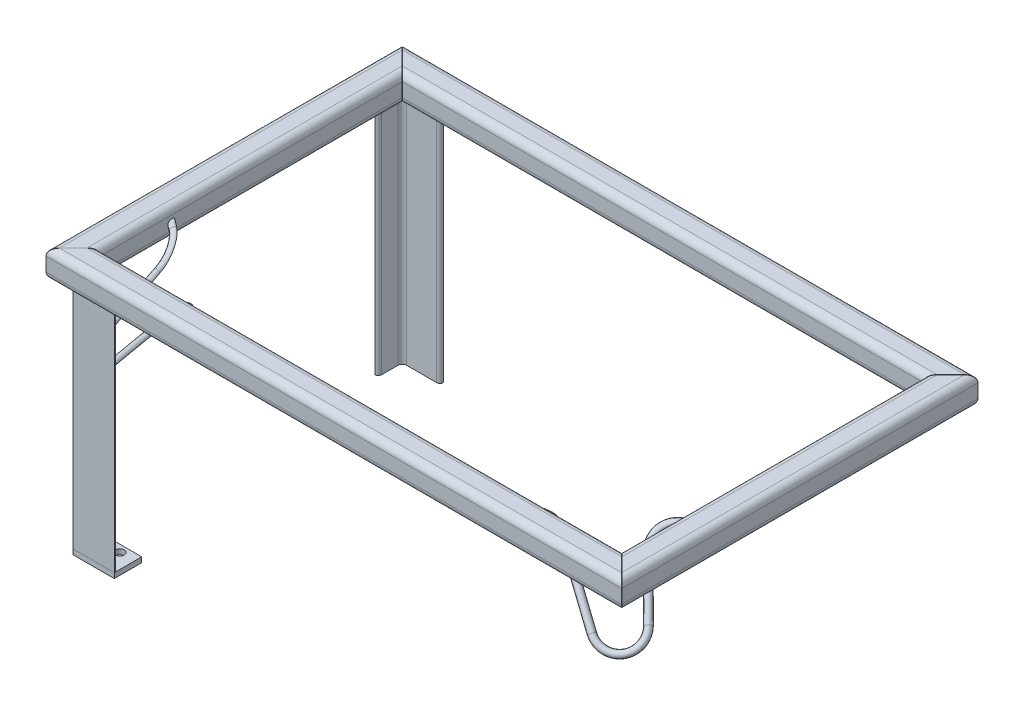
SolidWorks part; units mm, degrees
ref_plane "Front Plane" through (0, 0, 0) normal (0, 0, 1) x (1, 0, 0)
ref_plane "Top Plane" through (0, 0, 0) normal (0, 1, 0) x (1, 0, 0)
ref_plane "Right Plane" through (0, 0, 0) normal (1, 0, 0) x (0, 0, -1)
ref_plane "Plane5" through (0, 0, -12.7) normal (0, 0, 1) x (1, 0, 0)
ref_plane "Plane6" through (12.7, 0, 0) normal (1, 0, 0) x (0, 0, -1)
sketch3d "3DSketch1"
  line L0 (0, 0, 0) -> (0, 457.2, 0)
  line L1 (0, 457.2, 0) -> (1016, 457.2, 0)
  line L2 (1016, 457.2, 0) -> (1016, 0, 0)
  line L3 (1016, 457.2, 0) -> (1016, 457.2, -609.6)
  line L4 (1016, 457.2, -609.6) -> (1016, 0, -609.6)
  line L5 (1016, 457.2, -609.6) -> (0, 457.2, -609.6)
  line L6 (0, 457.2, -609.6) -> (0, 457.2, 0)
  line L7 (0, 457.2, -609.6) -> (0, 0, -609.6)
  line L8 (1016, 457.2, -177.8) -> (975.9009, 457.2, -146.6118)
  line L9 (960.2029, 423.4969, -104.912) -> (999.4101, 344.4933, -66.2784)
  line L10 (946.8823, 331.189, -13.7822) -> (864.3289, 436.8012, -41.9846)
  line L11 (827.4991, 457.2, -31.1882) -> (787.4, 457.2, 0)
  line L13 (0, 457.2, -177.8) -> (40.0991, 457.2, -146.6118)
  line L14 (55.7971, 423.4969, -104.912) -> (16.5899, 344.4933, -66.2784)
  line L15 (69.1177, 331.189, -13.7822) -> (151.6711, 436.8012, -41.9846)
  line L16 (188.5009, 457.2, -31.1882) -> (228.6, 457.2, 0)
  arc A0 (40.0991, 457.2, -146.6118) -> (55.7971, 423.4969, -104.912) centre (26.8058, 425.8507, -129.5204) ccw
  arc A1 (16.5899, 344.4933, -66.2784) -> (69.1177, 331.189, -13.7822) centre (45.5813, 342.1396, -41.67) ccw
  arc A2 (151.6711, 436.8012, -41.9846) -> (188.5009, 457.2, -31.1882) centre (175.2076, 425.8507, -14.0968) ccw
  arc A3 (975.9009, 457.2, -146.6118) -> (960.2029, 423.4969, -104.912) centre (989.1942, 425.8507, -129.5204) ccw
  arc A4 (999.4101, 344.4933, -66.2784) -> (946.8823, 331.189, -13.7822) centre (970.4187, 342.1396, -41.67) ccw
  arc A5 (864.3289, 436.8012, -41.9846) -> (827.4991, 457.2, -31.1882) centre (840.7924, 425.8507, -14.0968) ccw
  point P2 (1016, 457.2, -177.8)
  point P10 (0, 254, 0)
  point P11 (228.6, 457.2, 0)
  point P12 (0, 457.2, -177.8)
  point P13 (787.4, 457.2, 0)
  point P14 (1016, 254, 0)
  point P18 (1008.4409, 447.5031, -104.7747)
  point P22 (951.1721, 320.4871, -66.4157)
  point P26 (860.039, 447.5031, 10.6489)
  point P31 (46.0524, 404.1982, -154.2661)
  point P35 (26.3346, 363.792, -16.9243)
  point P39 (194.4542, 404.1982, -38.8424)
  dimension "D9" = 38.1
  dimension "D1" = 457.2
  dimension "D2" = 609.6
  dimension "D3" = 1016
  dimension "D4" = 203.2
  dimension "D5" = 177.8
  dimension "D6" = 228.6
  dimension "D7" = 228.6
  dimension "D8" = 12.7
  dimension "D10" = 50.8
sketch "Sketch17" plane through (-72.9198, 82.0348, 93.7541) normal (-0.5052, 0.5683, 0.6495) x (0.863, 0.3327, 0.3802)
  line L0 (33.6587, 489.0671) -> (16.3647, 454.6331)
other "Structural Member1"
ref_plane "Plane1" through (0, 457.2, 0) normal (0, 0, -1) x (-1, 0, 0)
sketch "Sketch1" plane through (0, 457.2, 0) normal (0, 0, -1) x (-1, 0, 0)
  line L0 (-12.7, -19.05) -> (12.7, -19.05)
  line L1 (-19.05, -12.7) -> (-19.05, 12.7)
  line L2 (12.7, 19.05) -> (-12.7, 19.05)
  line L3 (19.05, 12.7) -> (19.05, -12.7)
  line L4 (-12.7, -25.4) -> (12.7, -25.4)
  line L5 (-25.4, -12.7) -> (-25.4, 12.7)
  line L6 (12.7, 25.4) -> (-12.7, 25.4)
  line L7 (25.4, 12.7) -> (25.4, -12.7)
  line L8 (0, 0) -> (19.05, 0) construction
  line L9 (0, 0) -> (0, 19.05) construction
  arc A0 (25.4, 12.7) -> (12.7, 25.4) centre (12.7, 12.7) ccw
  arc A1 (12.7, -25.4) -> (25.4, -12.7) centre (12.7, -12.7) ccw
  arc A2 (-25.4, -12.7) -> (-12.7, -25.4) centre (-12.7, -12.7) ccw
  arc A3 (-12.7, 25.4) -> (-25.4, 12.7) centre (-12.7, 12.7) ccw
  arc A4 (-12.7, 19.05) -> (-19.05, 12.7) centre (-12.7, 12.7) ccw
  arc A5 (19.05, 12.7) -> (12.7, 19.05) centre (12.7, 12.7) ccw
  arc A6 (12.7, -19.05) -> (19.05, -12.7) centre (12.7, -12.7) ccw
  arc A7 (-19.05, -12.7) -> (-12.7, -19.05) centre (-12.7, -12.7) ccw
  point P3 (0, 25.4)
  point P4 (25.4, 0)
  point P5 (0, -25.4)
  point P6 (-25.4, 0)
  point P7 (-25.4, 25.4)
  point P8 (-25.4, -25.4)
  point P33 (0, 0)
  point P35 (25.4, -25.4)
  point P36 (25.4, 25.4)
  point P37 (0, 0)
  dimension "D1" = 12.7
  dimension "Thickness" = 6.35
  dimension "V_leg" = 50.8
other "Structural Member2"
ref_plane "Plane3" through (0, 0, 0) normal (0, 1, 0) x (-1, 0, 0)
sketch "Sketch12" plane through (0, 0, 0) normal (0, -1, 0) x (0, 0, -1)
  line L0 (0, 0) -> (0, 76.2)
  line L1 (0, 76.2) -> (0.0051, 76.2)
  line L2 (6.35, 69.8551) -> (6.35, 14.2875)
  line L3 (14.2875, 6.35) -> (44.4551, 6.35)
  line L4 (50.8, 0.0051) -> (50.8, 0)
  line L5 (50.8, 0) -> (0, 0)
  arc A0 (50.8, 0.0051) -> (44.4551, 6.35) centre (44.4551, 0.0051) ccw
  arc A1 (0.0051, 76.2) -> (6.35, 69.8551) centre (0.0051, 69.8551) cw
  arc A2 (14.2875, 6.35) -> (6.35, 14.2875) centre (14.2875, 14.2875) cw
  point P10 (25.4, 0)
  point P14 (0, 38.1)
  point P15 (6.35, 38.1)
  point P16 (25.4, 6.35)
  point P17 (6.35, 76.2)
  point P18 (50.8, 6.35)
  point P19 (0, 0)
  dimension "D2" = 0.0051
  dimension "D3" = 76.2
  dimension "Radius_1" = 7.9375
  dimension "D1" = 6.35
  dimension "H_leg" = 50.8
other "Structural Member3"
ref_plane "Plane4" through (0, 457.2, -609.6) normal (0, -1, 0) x (1, 0, 0)
sketch "Sketch13" plane through (0, 457.2, -609.6) normal (0, 1, 0) x (0, 0, 1)
  line L0 (0, 0) -> (0, 76.2)
  line L1 (0, 76.2) -> (0.0051, 76.2)
  line L2 (6.35, 69.8551) -> (6.35, 14.2875)
  line L3 (14.2875, 6.35) -> (44.4551, 6.35)
  line L4 (50.8, 0.0051) -> (50.8, 0)
  line L5 (50.8, 0) -> (0, 0)
  arc A0 (50.8, 0.0051) -> (44.4551, 6.35) centre (44.4551, 0.0051) ccw
  arc A1 (0.0051, 76.2) -> (6.35, 69.8551) centre (0.0051, 69.8551) cw
  arc A2 (14.2875, 6.35) -> (6.35, 14.2875) centre (14.2875, 14.2875) cw
  point P10 (25.4, 0)
  point P14 (0, 38.1)
  point P15 (6.35, 38.1)
  point P16 (25.4, 6.35)
  point P17 (6.35, 76.2)
  point P18 (50.8, 6.35)
  point P19 (0, 0)
  dimension "D2" = 0.0051
  dimension "D3" = 76.2
  dimension "Radius_1" = 7.9375
  dimension "D1" = 6.35
  dimension "H_leg" = 50.8
other "Trim/Extend1"
other "Structural Member4"
ref_plane "Plane7" through (0, 457.2, -177.8) normal (0.7894, 0, 0.6139) x (0.6139, 0, -0.7894)
sketch "Sketch16" plane through (0, 457.2, -177.8) normal (0.7894, 0, 0.6139) x (0.3489, 0.8228, -0.4486)
  line L0 (-6.35, 0) -> (6.35, 0)
  arc A0 (6.35, 0) -> (-6.35, 0) centre (0, 0) ccw
  point P1 (0, 0)
  dimension "D1" = 12.7
other "Trim/Extend2"
sketch "Sketch18" plane through (0, 0, 0) normal (0, -1, 0) x (1, 0, 0)
  line L0 (0, 0) -> (0, -50.8) construction
  line L1 (0, 0) -> (76.2, 0)
  line L2 (0, 0) -> (0, -50.8)
  line L3 (0, -50.8) -> (76.2, -50.8)
  line L4 (76.2, 0) -> (76.2, -50.8)
extrude "Extrude1" add sketch "Sketch18" along normal blind 9.525 separate body
sketch "Sketch19" plane through (0, 482.6, 0) normal (0, 1, 0) x (1, 0, 0)
  line L0 (-25.1194, -25.6806) -> (28.7622, 28.2009)
  line L1 (28.7622, 28.2009) -> (28.2009, 28.7622)
  line L2 (28.2009, 28.7622) -> (-25.6806, -25.1194)
  line L3 (-25.6806, -25.1194) -> (-25.1194, -25.6806)
  line L4 (-12.7, -12.7) -> (12.7, 12.7) construction
  line L5 (-12.7, -12.7) -> (-25.4, -25.4) construction
  line L6 (-12.7, -12.7) -> (12.7, 12.7) construction
  line L7 (-27.2214, 636.2601) -> (26.6601, 582.3786)
  line L8 (-27.2214, 636.2601) -> (-26.6601, 636.8214)
  line L9 (26.6601, 582.3786) -> (27.2214, 582.9399)
  line L10 (-26.6601, 636.8214) -> (27.2214, 582.9399)
  line L11 (-27.2214, 636.2601) -> (27.2214, 582.9399) construction
  line L12 (26.6601, 582.3786) -> (-26.6601, 636.8214) construction
  line L13 (-12.7, 622.3) -> (12.7, 596.9) construction
  line L14 (989.3399, 582.3786) -> (1043.2214, 636.2601)
  line L15 (989.3399, 582.3786) -> (988.7786, 582.9399)
  line L16 (1043.2214, 636.2601) -> (1042.6601, 636.8214)
  line L17 (988.7786, 582.9399) -> (1042.6601, 636.8214)
  line L18 (989.3399, 582.3786) -> (1042.6601, 636.8214) construction
  line L19 (1043.2214, 636.2601) -> (988.7786, 582.9399) construction
  line L20 (1028.7, 622.3) -> (1003.3, 596.9) construction
  line L21 (988.7786, 26.6601) -> (1042.6601, -27.2214)
  line L22 (988.7786, 26.6601) -> (989.3399, 27.2214)
  line L23 (1042.6601, -27.2214) -> (1043.2214, -26.6601)
  line L24 (989.3399, 27.2214) -> (1043.2214, -26.6601)
  line L25 (988.7786, 26.6601) -> (1043.2214, -26.6601) construction
  line L26 (1042.6601, -27.2214) -> (989.3399, 27.2214) construction
  line L27 (1028.7, -12.7) -> (1003.3, 12.7) construction
  line L28 (-12.7, 622.3) -> (12.7, 596.9) construction
  point P12 (0, 609.6)
  point P19 (1016, 609.6)
  point P26 (1016, 0)
  dimension "D1" = 0.7937
  dimension "D2" = 76.2
sketch "Sketch112" plane through (332.1904, 373.7142, 427.102) normal (0.5052, 0.5683, 0.6495) x (0.863, -0.3327, -0.3802)
  line L0 (558.7502, 189.6816) -> (621.6628, 231.7108)
other "Structural Member5"
ref_plane "Plane9" through (827.4991, 457.2, -31.1882) normal (-0.7894, 0, 0.6139) x (0.6139, 0, 0.7894)
sketch "Sketch113" plane through (827.4991, 457.2, -31.1882) normal (-0.7894, 0, 0.6139) x (0.3489, -0.8228, 0.4486)
  line L0 (-6.35, 0) -> (6.35, 0)
  arc A0 (6.35, 0) -> (-6.35, 0) centre (0, 0) ccw
  point P1 (0, 0)
  dimension "D1" = 12.7
other "Trim/Extend3"
extrude "Extrude3" cut sketch "Sketch19" against normal through all
sketch "Sketch115" plane through (0, 0, 0) normal (-1, 0, 0) x (0, 0, 1)
  line L0 (0, -9.525) -> (0, 0) construction
  line L1 (-50.8, -9.525) -> (0, -9.525)
  line L2 (-50.8, -9.525) -> (-50.8, -7.9375)
  line L3 (-50.8, -7.9375) -> (0, -7.9375)
  line L4 (0, -9.525) -> (0, -7.9375)
  dimension "D1" = 1.5875
extrude "MillFootFlat" [suppressed] cut sketch "Sketch115" against normal up to next
hole_wizard "5/8 Clearance Hole1" positions "Sketch117" profile "Sketch116" hole size "5/8" standard "Ansi Inch"
sketch "Sketch117" plane through (0, 0, 0) normal (0, 1, 0) x (-1, 0, 0)
  point P0 (-48.7244, -37.5196)
sketch "Sketch116" plane through (48.7244, 0, -37.5196) normal (1, 0, 0) x (0, 0, 1)
  line L0 (0, 0) -> (0, 9.525)
  line L1 (0, 9.525) -> (8.3337, 9.525)
  line L2 (8.3337, 9.525) -> (8.3337, 0)
  line L5 (8.3337, 0) -> (0, 0)
  line L11 (0, -6.35) -> (0, 107.95) construction
  dimension "Thru Hole Dia." = 16.6675
  dimension "Thru Hole Depth" = 9.525
other "Save Bodies1"
